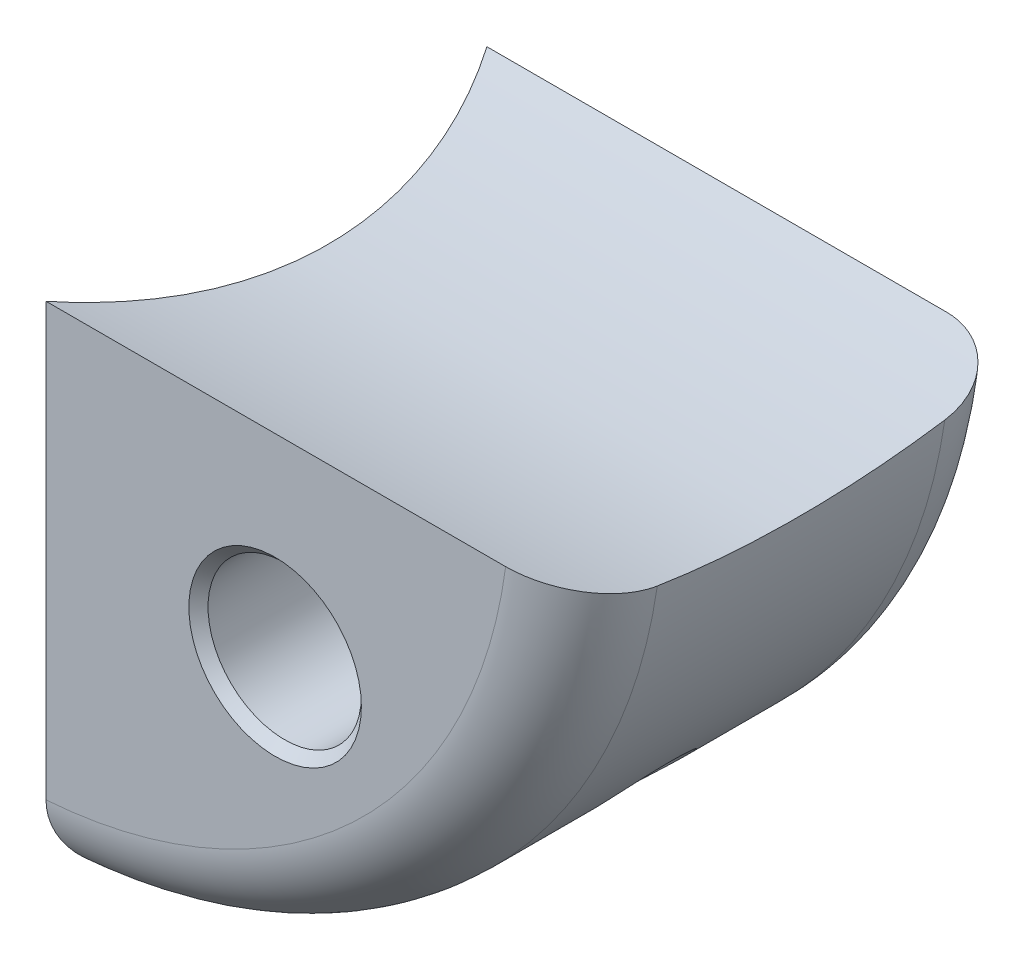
SolidWorks part; units mm, degrees
ref_plane "Plan 1" through (0, 0, 0) normal (0, 0, 1) x (1, 0, 0)
ref_plane "Plan 2" through (0, 0, 0) normal (0, 1, 0) x (1, 0, 0)
ref_plane "Plan 3" through (0, 0, 0) normal (1, 0, 0) x (0, 0, -1)
sketch "Esquisse1" plane through (0, 0, 0) normal (0, 0, 1) x (1, 0, 0)
  circle A0 centre (0, 0) radius 60
  dimension "D1" = 120
extrude "Brut" add sketch "Esquisse1" along normal mid plane 46
fillet "Arrondi" radius 8 2 edges at (60, 0, -23) (60, 0, 23)
sketch "Esquisse2" plane through (0, 0, 0) normal (1, 0, 0) x (0, 0, -1)
  line L0 (-23, 52) -> (-23, -52) construction
  line L1 (-23, 52) -> (-23, -6.8291)
  line L2 (15, 60) -> (-15, 60) construction
  line L3 (15, 60) -> (-15, 60)
  line L4 (23, -52) -> (23, 52) construction
  line L5 (23, -6.8291) -> (23, 52)
  arc A0 (-23, -6.8291) -> (23, -6.8291) centre (0, 75) ccw
  arc A1 (-15, 60) -> (-23, 52) centre (-15, 52) ccw construction
  arc A2 (-15, 60) -> (-23, 52) centre (-15, 52) ccw
  arc A3 (23, 52) -> (15, 60) centre (15, 52) ccw construction
  arc A4 (23, 52) -> (15, 60) centre (15, 52) ccw
  dimension "D1" = 85
  dimension "D2" = 10
extrude "Découpe sur X" cut sketch "Esquisse2" against normal through all and the other way through all
sketch "Esquisse3" plane through (0, 0, 0) normal (0, 1, 0) x (1, 0, 0)
  line L0 (-51.5496, 23) -> (51.5496, 23) construction
  line L1 (-51.5496, 23) -> (3.5953, 23)
  line L2 (-51.5496, -23) -> (51.5496, -23) construction
  line L3 (-51.5496, -23) -> (3.5953, -23)
  arc A0 (3.5953, -23) -> (3.5953, 23) centre (-34.5, 0) ccw
  spline S0 degree 3 poles (154.7004, 3010.4649) (77.2493, -787.2911) (13.7206, 29.3997) (-52.5965, 22.9364) (-52.8598, 22.8976) (-53.6378, 22.7429) (-54.1378, 22.5903) (-55.1013, 22.1879) (-55.569, 21.9345) (-56.4289, 21.3486) (-56.8252, 21.0156) (-57.3689, 20.4554) (-57.5417, 20.258) (-57.8629, 19.8516) (-58.0123, 19.6415) (-58.2892, 19.2077) (-58.4168, 18.9841) (-58.6498, 18.5232) (-58.7558, 18.2846) (-59.0356, 17.5584) (-59.1717, 17.0622) (-64.3796, -13.2222) (99.5522, -94.9997) (963.7892, 2829.2926) knots -15.710632 -15.710632 -15.710632 -15.710632 0.0625 0.0625 0.125 0.125 0.25 0.25 0.375 0.375 0.5 0.5 0.5625 0.5625 0.625 0.625 0.6875 0.6875 0.75 0.75 0.875 0.875 8.201825 8.201825 8.201825 8.201825 only from (-51.5496, 23) to (-59.3709, 15) construction
  spline S1 degree 3 poles (-51.5496, 23) (-51.8113, 23) (-52.073, 22.9874) (-52.5965, 22.9364) (-52.8598, 22.8976) (-53.6378, 22.7429) (-54.1378, 22.5903) (-55.1013, 22.1879) (-55.569, 21.9345) (-56.4289, 21.3486) (-56.8252, 21.0156) (-57.3689, 20.4554) (-57.5417, 20.258) (-57.8629, 19.8516) (-58.0123, 19.6415) (-58.2892, 19.2077) (-58.4168, 18.9841) (-58.6498, 18.5232) (-58.7558, 18.2846) (-59.0356, 17.5584) (-59.1717, 17.0622) (-59.3464, 16.0462) (-59.3846, 15.5231) (-59.3709, 15) knots 0 0 0 0 0.0625 0.0625 0.125 0.125 0.25 0.25 0.375 0.375 0.5 0.5 0.5625 0.5625 0.625 0.625 0.6875 0.6875 0.75 0.75 0.875 0.875 1 1 1 1
  spline S2 degree 3 poles (2830.1399, -648.9208) (-191.5845, -435.1139) (-62.3082, -221.3069) (-59.1797, -5) (-59.1419, 0) (-59.1797, 5) (-62.3082, 221.3063) (-191.5838, 435.1127) (2830.1152, 648.919) knots -21.130693 -21.130693 -21.130693 -21.130693 0.25 0.25 0.5 0.75 0.75 22.130634 22.130634 22.130634 22.130634 only from (-59.3709, -15) to (-59.3709, 15) construction
  spline S3 degree 3 poles (-59.3709, -15) (-59.3054, -12.5) (-59.252, -10) (-59.1797, -5) (-59.1419, 0) (-59.1797, 5) (-59.252, 10) (-59.3054, 12.5) (-59.3709, 15) knots 0 0 0 0 0.25 0.25 0.5 0.75 0.75 1 1 1 1
  spline S4 degree 3 poles (2867.8421, 634.8471) (380.0564, 152.989) (-67.6022, 32.2504) (-59.217, -16.8004) (-59.1612, -17.0522) (-59.024, -17.5519) (-58.9422, -17.8007) (-58.6631, -18.5252) (-58.4315, -18.9841) (-57.8769, -19.8543) (-57.5503, -20.2681) (-56.8302, -21.0107) (-56.4346, -21.3444) (-55.7861, -21.7868) (-55.5601, -21.9246) (-55.1, -22.174) (-54.6293, -22.3992) (-54.1375, -22.5766) (-53.6351, -22.73) (-53.3771, -22.7948) (20.9168, -37.5505) (165.866, 1017.7267) (-11.2065, -3014.8786) knots -11.891045 -11.891045 -11.891045 -11.891045 0.125 0.125 0.1875 0.1875 0.25 0.25 0.375 0.375 0.5 0.5 0.625 0.625 0.6875 0.6875 0.75 0.8125 0.8125 0.875 0.875 18.699727 18.699727 18.699727 18.699727 only from (-59.3709, -15) to (-51.5496, -23) construction
  spline S5 degree 3 poles (-59.3709, -15) (-59.3846, -15.5235) (-59.3471, -16.0389) (-59.217, -16.8004) (-59.1612, -17.0522) (-59.024, -17.5519) (-58.9422, -17.8007) (-58.6631, -18.5252) (-58.4315, -18.9841) (-57.8769, -19.8543) (-57.5503, -20.2681) (-56.8302, -21.0107) (-56.4346, -21.3444) (-55.7861, -21.7868) (-55.5601, -21.9246) (-55.1, -22.174) (-54.6293, -22.3992) (-54.1375, -22.5766) (-53.6351, -22.73) (-53.3771, -22.7948) (-52.5983, -22.9495) (-52.0756, -23) (-51.5496, -23) knots 0 0 0 0 0.125 0.125 0.1875 0.1875 0.25 0.25 0.375 0.375 0.5 0.5 0.625 0.625 0.6875 0.6875 0.75 0.8125 0.8125 0.875 0.875 1 1 1 1
  dimension "D1" = 44.5
  dimension "D2" = 10
extrude "Découpe sur Y" cut sketch "Esquisse3" against normal through all
hole_wizard "Perçage axe palette" positions "Esquisse6" profile "Esquisse5" hole size "Ø16.0" standard "ISO"
sketch "Esquisse6" plane through (0, 0, 23) normal (0, 0, 1) x (1, 0, 0)
  line L0 (10, -59.1608) -> (10, -10) construction
  line L1 (10, -10) -> (59.1608, -10) construction
  point P0 (27.5, -27)
  dimension "D1" = 17.5
  dimension "D2" = 17
sketch "Esquisse5" plane through (27.5, -27, 23) normal (1, 0, 0) x (0, -1, 0)
  line L0 (0, 0) -> (0, 46.4675)
  line L1 (0, 46.4675) -> (9, 46.4675)
  line L2 (8, 45.4675) -> (8, 1)
  line L3 (8, 1) -> (9, 0)
  line L5 (9, 0) -> (0, 0)
  line L6 (-8, 1) -> (-9, 0) construction
  line L7 (9, 46.4675) -> (8, 45.4675)
  line L8 (-9, 46.4675) -> (-8, 45.4675) construction
  line L11 (0, -6.35) -> (0, 107.95) construction
  dimension "Diamètre du perçage jusqu'au prochain" = 16
  dimension "Profondeur du perçage jusqu'au prochain" = 46.4675
  dimension "Diamètre du fraisage entrant" = 18
  dimension "Angle du fraisage entrant" = 90
  dimension "Diamètre du fraisage débouchant" = 18
  dimension "Angle du fraisage débouchant" = 90
ref_plane "Plan1" through (0, 0, 0) normal (0.7071, 0.7071, 0) x (0, 0, -1)
ref_plane "Plan2" through (42.4264, -42.4264, 0) normal (0.7071, -0.7071, 0) x (-0.7071, -0.7071, 0)
hole_wizard "Taraudage M10" positions "Esquisse8" profile "Esquisse7" tap size "M10" standard "ISO"
sketch "Esquisse8" plane through (42.4264, -42.4264, 0) normal (0.7071, -0.7071, 0) x (-0.7071, -0.7071, 0)
  point P0 (0, 0)
sketch "Esquisse7" plane through (42.4264, -42.4264, 0) normal (0, 0, 1) x (0.7071, 0.7071, 0)
  line L0 (0, 0) -> (0, 13.4705)
  line L1 (0, 13.4705) -> (4.25, 13.4705)
  line L2 (4.25, 13.4705) -> (4.25, 0.775)
  line L3 (4.25, 0.775) -> (5.025, 0)
  line L5 (5.025, 0) -> (0, 0)
  line L6 (-4.25, 0.775) -> (-5.025, 0) construction
  line L11 (0, -6.35) -> (0, 107.95) construction
  dimension "Diamètre du trou pour taraudage jusqu'au prochain" = 8.5
  dimension "Profondeur du trou pour taraudage jusqu'au prochain" = 13.4705
  dimension "Diamètre du fraisage entrant" = 10.05
  dimension "Angle du fraisage entrant" = 90
